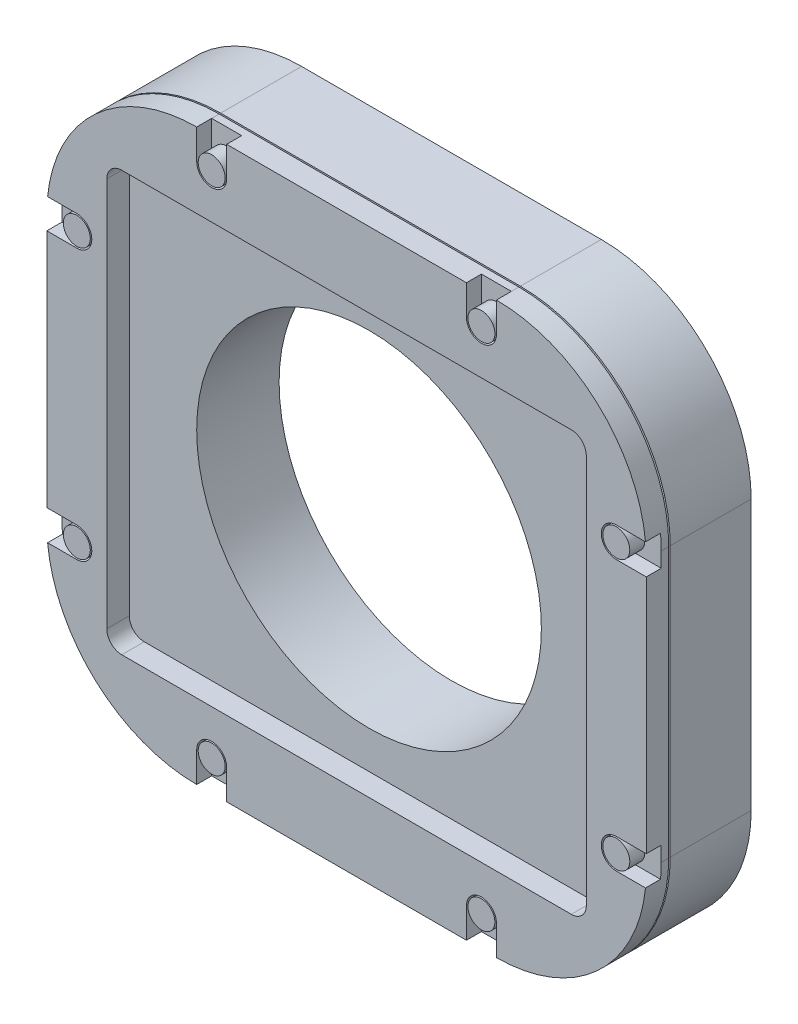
SolidWorks part; units mm, degrees
ref_plane "Plan de face" through (0, 0, 0) normal (0, 0, 1) x (1, 0, 0)
ref_plane "Plan de dessus" through (0, 0, 0) normal (0, 1, 0) x (1, 0, 0)
ref_plane "Plan de droite" through (0, 0, 0) normal (1, 0, 0) x (0, 0, -1)
sketch "Esquisse1" plane through (0, 0, 0) normal (0, 0, 1) x (1, 0, 0)
  line L1 (-10, 19) -> (10, 19)
  line L2 (-20, 9) -> (-20, -9)
  line L3 (-10, -19) -> (10, -19)
  line L4 (20, 9) -> (20, -9)
  circle A0 centre (0, 0) radius 11.5
  arc A1 (10, -19) -> (20, -9) centre (10, -9) ccw
  arc A2 (10, 19) -> (20, 9) centre (10, 9) cw
  arc A3 (-10, 19) -> (-20, 9) centre (-10, 9) ccw
  arc A4 (-20, -9) -> (-10, -19) centre (-10, -9) ccw
  point P9 (20, -19)
  point P12 (20, 19)
  point P15 (-20, 19)
  dimension "D5" = 23
  dimension "D6" = 10
  dimension "D1" = 40
  dimension "D2" = 38
  dimension "D3" = 20
  dimension "D4" = 19
extrude "Extrusion1" add sketch "Esquisse1" along normal blind 7
sketch "Esquisse2" plane through (0, 0, 7) normal (0, 0, 1) x (1, 0, 0)
  line L1 (-15, 14) -> (15, 14)
  line L2 (-16, 13) -> (-16, -13)
  line L3 (-15, -14) -> (15, -14)
  line L4 (16, 13) -> (16, -13)
  arc A0 (15, -14) -> (16, -13) centre (15, -13) ccw
  arc A1 (-15, 14) -> (-16, 13) centre (-15, 13) ccw
  arc A2 (15, 14) -> (16, 13) centre (15, 13) cw
  arc A3 (-16, -13) -> (-15, -14) centre (-15, -13) ccw
  point P7 (16, -14)
  point P10 (-16, 14)
  point P13 (16, 14)
  dimension "D5" = 1
  dimension "D1" = 28
  dimension "D2" = 14
  dimension "D3" = 32
  dimension "D4" = 16
extrude "Enlèv. mat.-Extru.1" cut sketch "Esquisse2" against normal blind 1.5
sketch "Esquisse3" plane through (0, 0, 7) normal (0, 0, 1) x (1, 0, 0)
  line L0 (0, 24.4533) -> (0, -23.2229) construction
  line L1 (10, 19) -> (-10, 19) construction
  line L2 (10, 19) -> (8, 19)
  line L3 (20, -9) -> (20, 9) construction
  line L4 (20, 8) -> (20, 9)
  line L5 (10, 17) -> (10, 19)
  line L6 (8, 17) -> (8, 19)
  line L7 (18, 8) -> (20, 8)
  line L8 (18, 10) -> (19.9499, 10)
  line L9 (-18, 10) -> (-19.9499, 10)
  line L10 (-18, 8) -> (-20, 8)
  line L11 (-8, 17) -> (-8, 19)
  line L12 (-10, 17) -> (-10, 19)
  line L13 (-20, 8) -> (-20, 9)
  line L14 (-10, 19) -> (-8, 19)
  line L15 (-25.2405, 0) -> (25.904, 0) construction
  line L16 (-10, -19) -> (-8, -19)
  line L17 (-20, -8) -> (-20, -9)
  line L18 (-10, -17) -> (-10, -19)
  line L19 (-8, -17) -> (-8, -19)
  line L20 (-18, -8) -> (-20, -8)
  line L21 (-18, -10) -> (-19.9499, -10)
  line L22 (18, -10) -> (19.9499, -10)
  line L23 (18, -8) -> (20, -8)
  line L24 (8, -17) -> (8, -19)
  line L25 (10, -17) -> (10, -19)
  line L26 (20, -8) -> (20, -9)
  line L27 (10, -19) -> (8, -19)
  arc A0 (8, 17) -> (10, 17) centre (9, 17) ccw
  arc A1 (18, 10) -> (18, 8) centre (18, 9) ccw
  arc A2 (20, 9) -> (10, 19) centre (10, 9) ccw construction
  arc A3 (20, 9) -> (19.9499, 10) centre (10, 9) ccw
  arc A4 (-20, 9) -> (-19.9499, 10) centre (-10, 9) cw
  arc A5 (-18, 10) -> (-18, 8) centre (-18, 9) cw
  arc A6 (-8, 17) -> (-10, 17) centre (-9, 17) cw
  arc A7 (-8, -17) -> (-10, -17) centre (-9, -17) ccw
  arc A8 (-18, -10) -> (-18, -8) centre (-18, -9) ccw
  arc A9 (-20, -9) -> (-19.9499, -10) centre (-10, -9) ccw
  arc A10 (20, -9) -> (19.9499, -10) centre (10, -9) cw
  arc A11 (18, -10) -> (18, -8) centre (18, -9) cw
  arc A12 (8, -17) -> (10, -17) centre (9, -17) cw
  dimension "D3" = 2
  dimension "D4" = 2
  dimension "D1" = 9
  dimension "D2" = 9
  dimension "D5" = 17
  dimension "D6" = 18
extrude "Enlèv. mat.-Extru.2" cut sketch "Esquisse3" against normal blind 1
sketch "Esquisse4" plane through (0, 0, 5.5) normal (0, 0, 1) x (1, 0, 0)
  line L0 (20, 8) -> (20, 9) construction
  line L1 (20, 8) -> (20, 9)
  line L2 (20, -8) -> (20, 8) construction
  line L3 (20, -8) -> (20, 8)
  line L4 (20, -9) -> (20, -8) construction
  line L5 (20, -9) -> (20, -8)
  line L6 (8, -19) -> (10, -19) construction
  line L7 (8, -19) -> (10, -19)
  line L8 (-8, -19) -> (8, -19) construction
  line L9 (-8, -19) -> (8, -19)
  line L10 (-10, -19) -> (-8, -19) construction
  line L11 (-10, -19) -> (-8, -19)
  line L12 (-20, -8) -> (-20, -9) construction
  line L13 (-20, -8) -> (-20, -9)
  line L14 (-20, 8) -> (-20, -8) construction
  line L15 (-20, 8) -> (-20, -8)
  line L16 (-20, 9) -> (-20, 8) construction
  line L17 (-20, 9) -> (-20, 8)
  line L18 (-8, 19) -> (-10, 19) construction
  line L19 (-8, 19) -> (-10, 19)
  line L20 (8, 19) -> (-8, 19) construction
  line L21 (8, 19) -> (-8, 19)
  line L22 (10, 19) -> (8, 19) construction
  line L23 (10, 19) -> (8, 19)
  line L24 (8, 18.5) -> (-8, 18.5)
  line L25 (-8, 18.5) -> (-10, 18.5)
  line L26 (-19.5, 9) -> (-19.5, 8)
  line L27 (-19.5, 8) -> (-19.5, -8)
  line L28 (-19.5, -8) -> (-19.5, -9)
  line L29 (-10, -18.5) -> (-8, -18.5)
  line L30 (-8, -18.5) -> (8, -18.5)
  line L31 (8, -18.5) -> (10, -18.5)
  line L32 (19.5, -9) -> (19.5, -8)
  line L33 (19.5, -8) -> (19.5, 8)
  line L34 (19.5, 8) -> (19.5, 9)
  line L35 (10, 18.5) -> (8, 18.5)
  arc A0 (19.9499, 10) -> (10, 19) centre (10, 9) ccw construction
  arc A1 (19.9499, 10) -> (10, 19) centre (10, 9) ccw
  arc A2 (20, 9) -> (19.9499, 10) centre (10, 9) ccw construction
  arc A3 (20, 9) -> (19.9499, 10) centre (10, 9) ccw
  arc A4 (19.9499, -10) -> (20, -9) centre (10, -9) ccw construction
  arc A5 (19.9499, -10) -> (20, -9) centre (10, -9) ccw
  arc A6 (10, -19) -> (19.9499, -10) centre (10, -9) ccw construction
  arc A7 (10, -19) -> (19.9499, -10) centre (10, -9) ccw
  arc A8 (-19.9499, -10) -> (-10, -19) centre (-10, -9) ccw construction
  arc A9 (-19.9499, -10) -> (-10, -19) centre (-10, -9) ccw
  arc A10 (-20, -9) -> (-19.9499, -10) centre (-10, -9) ccw construction
  arc A11 (-20, -9) -> (-19.9499, -10) centre (-10, -9) ccw
  arc A12 (-19.9499, 10) -> (-20, 9) centre (-10, 9) ccw construction
  arc A13 (-19.9499, 10) -> (-20, 9) centre (-10, 9) ccw
  arc A14 (-10, 19) -> (-19.9499, 10) centre (-10, 9) ccw construction
  arc A15 (-10, 19) -> (-19.9499, 10) centre (-10, 9) ccw
  arc A16 (-10, 18.5) -> (-19.4524, 9.95) centre (-10, 9) ccw
  arc A17 (-19.4524, 9.95) -> (-19.5, 9) centre (-10, 9) ccw
  arc A18 (-19.5, -9) -> (-19.4524, -9.95) centre (-10, -9) ccw
  arc A19 (-19.4524, -9.95) -> (-10, -18.5) centre (-10, -9) ccw
  arc A20 (10, -18.5) -> (19.4524, -9.95) centre (10, -9) ccw
  arc A21 (19.4524, -9.95) -> (19.5, -9) centre (10, -9) ccw
  arc A22 (19.5, 9) -> (19.4524, 9.95) centre (10, 9) ccw
  arc A23 (19.4524, 9.95) -> (10, 18.5) centre (10, 9) ccw
  dimension "D1" = 0.5
extrude "Enlèv. mat.-Extru.3" cut sketch "Esquisse4" against normal blind 0.1
sketch "Esquisse5" plane through (0, 0, 6) normal (0, 0, 1) x (1, 0, 0)
  line L0 (0, 0) -> (0, 25.0013) construction
  line L1 (-22.3875, 0) -> (24.1842, 0) construction
  circle A0 centre (9, 17) radius 0.9
  circle A1 centre (18, 9) radius 0.9
  circle A2 centre (-18, 9) radius 0.9
  circle A3 centre (-9, 17) radius 0.9
  circle A4 centre (-9, -17) radius 0.9
  circle A5 centre (-18, -9) radius 0.9
  circle A6 centre (18, -9) radius 0.9
  circle A7 centre (9, -17) radius 0.9
  dimension "D1" = 1.8
  dimension "D2" = 1.8
extrude "Extrusion2" add sketch "Esquisse5" along normal blind 1
